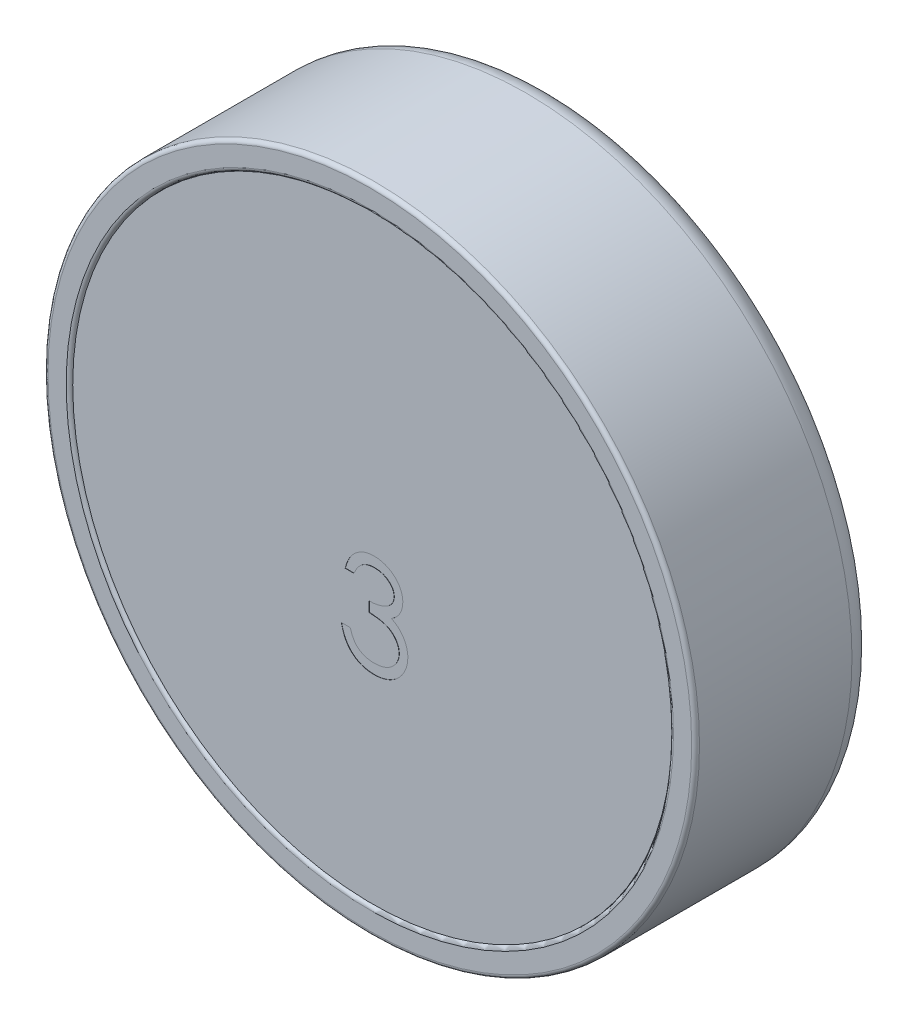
SolidWorks part; units mm, degrees
ref_plane "Front Plane" through (0, 0, 0) normal (0, 0, 1) x (1, 0, 0)
ref_plane "Top Plane" through (0, 0, 0) normal (0, 1, 0) x (1, 0, 0)
ref_plane "Right Plane" through (0, 0, 0) normal (1, 0, 0) x (0, 0, -1)
sketch "Sketch1" plane through (0, 0, 0) normal (0, 0, 1) x (1, 0, 0)
  circle A0 centre (0, 0) radius 31.75
extrude "Boss-Extrude1" add sketch "Sketch1" along normal blind 17.526
sketch "Sketch2" plane through (0, 0, 17.526) normal (0, 0, 1) x (1, 0, 0)
  circle A0 centre (0, 0) radius 29.21
extrude "Cut-Extrude1" cut sketch "Sketch2" against normal blind 12.446
sketch "Sketch4" plane through (0, 0, 0) normal (0, 0, -1) x (-1, 0, 0)
  circle A0 centre (0, 0) radius 6.35
extrude "Boss-Extrude2" add sketch "Sketch4" along normal blind 3.175
sketch "Sketch5" plane through (0, 0, -3.175) normal (0, 0, -1) x (-1, 0, 0)
  circle A0 centre (0, 0) radius 7.9375
extrude "Boss-Extrude3" add sketch "Sketch5" along normal blind 8.255
chamfer "Chamfer1" distance 0.762 angle 45 2 edges at (-7.9375, 0, -11.43) (-7.9375, 0, -3.175)
fillet "Fillet1" radius 0.762 1 edges at (6.35, 0, 0)
fillet "Fillet2" radius 1.524 1 edges at (29.21, 0, 5.08)
fillet "Fillet3" radius 2.286 1 edges at (31.75, 0, 0)
fillet "Fillet4" radius 0.381 2 edges at (29.21, 0, 17.526) (31.75, 0, 17.526)
sketch "Sketch6" plane through (0, 0, -11.43) normal (0, 0, -1) x (-1, 0, 0)
  circle A0 centre (0, 0) radius 1.524
extrude "Cut-Extrude3" cut sketch "Sketch6" against normal blind 28.575
chamfer "Chamfer2" distance 0.762 angle 45 1 edges at (1.524, 0, 5.08)
sketch "Sketch7" plane through (0, 0, -11.43) normal (0, 0, -1) x (-1, 0, 0)
  line L0 (7.5139, 5.08) -> (7.5139, 9.0987)
  line L1 (0, 5.08) -> (7.5139, 5.08)
  line L2 (7.5139, 9.0987) -> (-6.8921, 9.0987)
  line L3 (0, -5.08) -> (7.4158, -5.08)
  line L4 (7.4158, -5.08) -> (7.4158, -8.8808)
  line L5 (7.4158, -8.8808) -> (-6.8921, -8.8808)
  line L6 (-6.8921, -8.8808) -> (-6.8921, -5.08)
  line L7 (-6.8921, -5.08) -> (0, -5.08)
  line L8 (-6.8921, 9.0987) -> (-6.8921, 5.08)
  line L9 (-6.8921, 5.08) -> (0, 5.08)
extrude "Cut-Extrude4" cut sketch "Sketch7" against normal blind 8.255
chamfer "Chamfer3" distance 0.762 angle 45 1 edges at (-1.524, 0, -11.43)
sketch "Sketch16" plane through (-9.421, 2.2653, 0) normal (0, 0, -1) x (-1, 0, 0)
  line L0 (-9.421, 27.1987) -> (-9.421, -2.2653) construction
  circle A0 centre (-9.421, -2.2653) radius 29.464 construction
ref_plane "Plane3" through (0, 0, 0) normal (0, -1, 0) x (1, 0, 0)
sketch "#2-023 Groove Sketch" plane through (0, 0, 0) normal (0, 1, 0) x (0, 0, -1)
  line L0 (-1.0889, -13.3477) -> (0, -13.2524)
  line L1 (0, -13.2524) -> (0, -16.0846)
  line L2 (0, -16.0846) -> (-1.0889, -15.9893)
  line L3 (-1.3208, -15.7363) -> (-1.3208, -13.6007)
  line L4 (0, 0) -> (-1.5769, 0) construction
  line L6 (0, -29.464) -> (0, 29.464) construction
  arc A0 (-1.0889, -15.9893) -> (-1.3208, -15.7363) centre (-1.0668, -15.7363) cw
  arc A1 (-1.3208, -13.6007) -> (-1.0889, -13.3477) centre (-1.0668, -13.6007) cw
  dimension "D1" = 10
  dimension "Radius" = 0.254
  dimension "ID" = 26.6954
  dimension "OD" = 31.9786
  dimension "Depth" = 1.3208
revolve "O-Ring Groove" cut sketch "#2-023 Groove Sketch" angle 360 about L4
other "face static - liquid (as 568)<1>"
sketch "Sketch17" plane through (0, 0, 5.08) normal (0, 0, 1) x (1, 0, 0)
  circle A0 centre (0, 0) radius 29.21
extrude "Boss-Extrude4" add sketch "Sketch17" along normal blind 12.192
sketch "Sketch18" plane through (0, 0, 17.272) normal (0, 0, 1) x (1, 0, 0)
  line L0 (-10.7156, -9.525) -> (10.7156, -9.525) construction
  line L1 (0, -9.525) -> (0, 0) construction
  text T0 "  0" font "Century Gothic" height in points 36
  dimension "D1" = 9.525
  dimension "D2" = 21.4312
extrude "Beam 0 Cut-Extrude5" [suppressed] cut sketch "Sketch18" against normal blind 0.0254
sketch "Sketch19" plane through (0, 0, 17.272) normal (0, 0, 1) x (1, 0, 0)
  line L0 (-10.7156, -9.525) -> (10.7156, -9.525) construction
  line L1 (0, -9.525) -> (0, 0) construction
  text T0 "  1" font "Century Gothic" height in points 36
  dimension "D1" = 9.525
  dimension "D2" = 21.4312
extrude "Beam 1 Cut-Extrude5" [suppressed] cut sketch "Sketch19" against normal blind 0.0254
sketch "Sketch20" plane through (0, 0, 17.272) normal (0, 0, 1) x (1, 0, 0)
  line L0 (-10.7156, -9.525) -> (10.7156, -9.525) construction
  line L1 (0, -9.525) -> (0, 0) construction
  text T0 "  2" font "Century Gothic" height in points 36
  dimension "D1" = 9.525
  dimension "D2" = 21.4312
extrude "Beam 2 Cut-Extrude5" [suppressed] cut sketch "Sketch20" against normal blind 0.0254
sketch "Sketch21" plane through (0, 0, 17.272) normal (0, 0, 1) x (1, 0, 0)
  line L0 (-10.7156, -9.525) -> (10.7156, -9.525) construction
  line L1 (0, -9.525) -> (0, 0) construction
  text T0 "  3" font "Century Gothic" height in points 36
  dimension "D1" = 21.4312
  dimension "D2" = 9.525
extrude "Beam 3 Cut-Extrude5" cut sketch "Sketch21" against normal blind 0.0254
